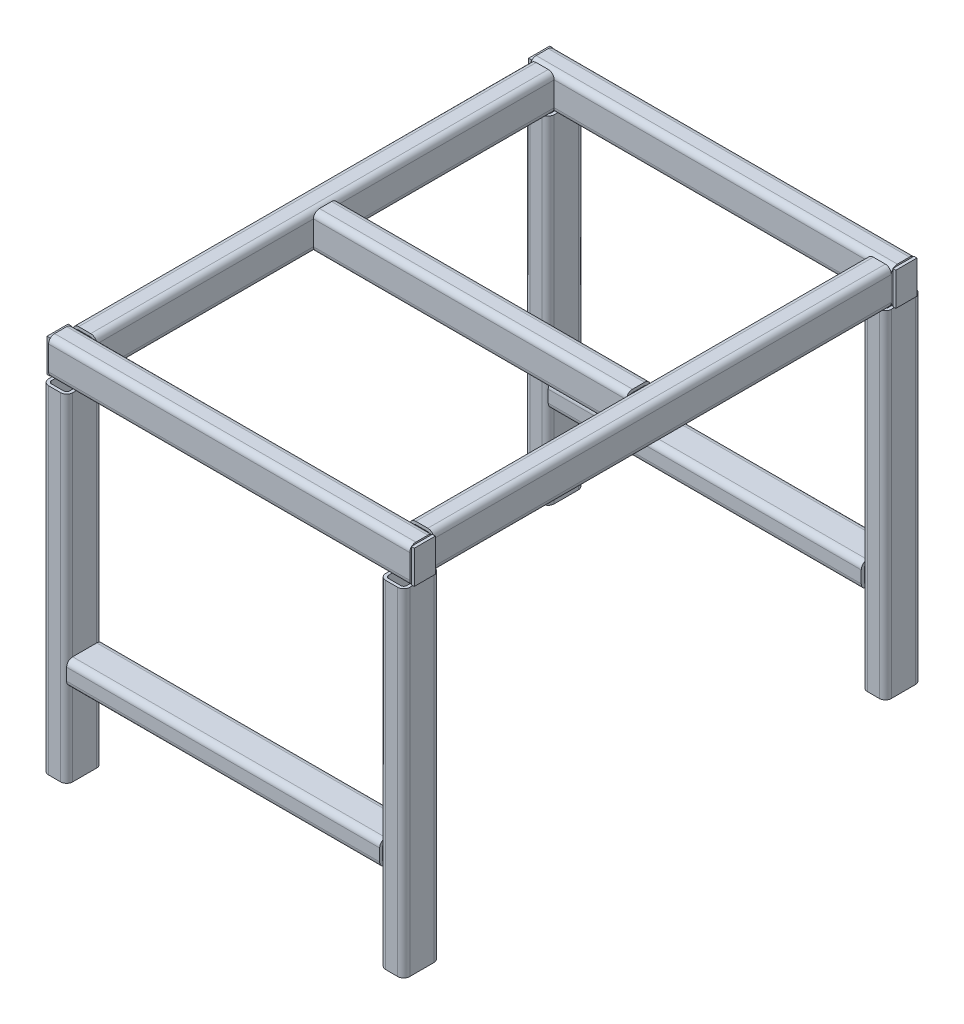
SolidWorks part; units mm, degrees
ref_plane "Front Plane" through (0, 0, 0) normal (0, 0, 1) x (1, 0, 0)
ref_plane "Top Plane" through (0, 0, 0) normal (0, 1, 0) x (1, 0, 0)
ref_plane "Right Plane" through (0, 0, 0) normal (1, 0, 0) x (0, 0, -1)
sketch "Sketch1" plane through (0, 0, 0) normal (0, 1, 0) x (1, 0, 0)
  line L0 (0, 0) -> (711.2, 0)
  line L1 (0, -508) -> (711.2, -508)
  line L2 (0, -508) -> (0, 508)
  line L3 (0, 508) -> (711.2, 508)
  line L4 (711.2, -508) -> (711.2, 508)
  dimension "D1" = 711.2
  dimension "D2" = 1016
ref_plane "Plane3" through (0, 0, 508) normal (0, 0, 1) x (1, 0, 0)
sketch "Sketch2" plane through (0, 0, 508) normal (0, 0, 1) x (1, 0, 0)
  line L0 (0, 0) -> (0, -711.2)
  line L1 (711.2, 0) -> (711.2, -711.2)
  line L2 (0, -508) -> (711.2, -508)
  dimension "D1" = 711.2
  dimension "D2" = 203.2
other "Structural Member1"
ref_plane "Plane1" through (0, 0, 508) normal (0, 0, -1) x (-1, 0, 0)
sketch "Sketch11" plane through (0, 38.1, 508) normal (0, 0, -1) x (-1, 0, 0)
  line L0 (-12.7, -31.75) -> (12.7, -31.75)
  line L1 (-19.05, -25.4) -> (-19.05, 25.4)
  line L2 (12.7, 31.75) -> (-12.7, 31.75)
  line L3 (19.05, 25.4) -> (19.05, -25.4)
  line L4 (-12.7, -38.1) -> (12.7, -38.1)
  line L5 (-25.4, -25.4) -> (-25.4, 25.4)
  line L6 (12.7, 38.1) -> (-12.7, 38.1)
  line L7 (25.4, 25.4) -> (25.4, -25.4)
  line L8 (0, 0) -> (25.4, 0) construction
  line L9 (0, 0) -> (0, 38.1) construction
  arc A0 (25.4, 25.4) -> (12.7, 38.1) centre (12.7, 25.4) ccw
  arc A1 (12.7, -38.1) -> (25.4, -25.4) centre (12.7, -25.4) ccw
  arc A2 (-25.4, -25.4) -> (-12.7, -38.1) centre (-12.7, -25.4) ccw
  arc A3 (-12.7, 38.1) -> (-25.4, 25.4) centre (-12.7, 25.4) ccw
  arc A4 (-12.7, 31.75) -> (-19.05, 25.4) centre (-12.7, 25.4) ccw
  arc A5 (19.05, 25.4) -> (12.7, 31.75) centre (12.7, 25.4) ccw
  arc A6 (12.7, -31.75) -> (19.05, -25.4) centre (12.7, -25.4) ccw
  arc A7 (-19.05, -25.4) -> (-12.7, -31.75) centre (-12.7, -25.4) ccw
  point P3 (0, -38.1)
  point P4 (-25.4, 0)
  point P5 (0, 0)
  point P6 (25.4, -38.1)
  point P7 (-25.4, -38.1)
  point P8 (-25.4, 38.1)
  point P33 (0, 0)
  point P35 (25.4, 38.1)
  point P36 (25.4, 0)
  point P37 (0, 38.1)
  dimension "D1" = 12.7
  dimension "Thickness" = 6.35
  dimension "V_leg" = 76.2
  dimension "H_leg" = 50.8
other "Structural Member2"
ref_plane "Plane2" through (0, 0, 508) normal (0, -1, 0) x (1, 0, 0)
sketch "Sketch12" plane through (0, 0, 508) normal (0, -1, 0) x (1, 0, 0)
  line L0 (-12.7, -31.75) -> (12.7, -31.75)
  line L1 (-19.05, -25.4) -> (-19.05, 25.4)
  line L2 (12.7, 31.75) -> (-12.7, 31.75)
  line L3 (19.05, 25.4) -> (19.05, -25.4)
  line L4 (-12.7, -38.1) -> (12.7, -38.1)
  line L5 (-25.4, -25.4) -> (-25.4, 25.4)
  line L6 (12.7, 38.1) -> (-12.7, 38.1)
  line L7 (25.4, 25.4) -> (25.4, -25.4)
  line L8 (0, 0) -> (25.4, 0) construction
  line L9 (0, 0) -> (0, 38.1) construction
  arc A0 (25.4, 25.4) -> (12.7, 38.1) centre (12.7, 25.4) ccw
  arc A1 (12.7, -38.1) -> (25.4, -25.4) centre (12.7, -25.4) ccw
  arc A2 (-25.4, -25.4) -> (-12.7, -38.1) centre (-12.7, -25.4) ccw
  arc A3 (-12.7, 38.1) -> (-25.4, 25.4) centre (-12.7, 25.4) ccw
  arc A4 (-12.7, 31.75) -> (-19.05, 25.4) centre (-12.7, 25.4) ccw
  arc A5 (19.05, 25.4) -> (12.7, 31.75) centre (12.7, 25.4) ccw
  arc A6 (12.7, -31.75) -> (19.05, -25.4) centre (12.7, -25.4) ccw
  arc A7 (-19.05, -25.4) -> (-12.7, -31.75) centre (-12.7, -25.4) ccw
  point P3 (0, -38.1)
  point P4 (-25.4, 0)
  point P5 (0, 0)
  point P6 (25.4, -38.1)
  point P7 (-25.4, -38.1)
  point P8 (-25.4, 38.1)
  point P33 (0, 0)
  point P35 (25.4, 38.1)
  point P36 (25.4, 0)
  point P37 (0, 38.1)
  dimension "D1" = 12.7
  dimension "Thickness" = 6.35
  dimension "V_leg" = 76.2
  dimension "H_leg" = 50.8
other "End cap1" parameters "D1"=6.35, "D2"=3.175, "D3"=3.175
other "End cap2" parameters "D1"=6.35, "D2"=3.175, "D3"=3.175
other "End cap3" parameters "D1"=6.35, "D2"=3.175, "D3"=3.175
other "End cap4" parameters "D1"=6.35, "D2"=3.175, "D3"=3.175
mirror "Mirror1" about plane through (0, 0, 0) normal (0, 0, 1)
